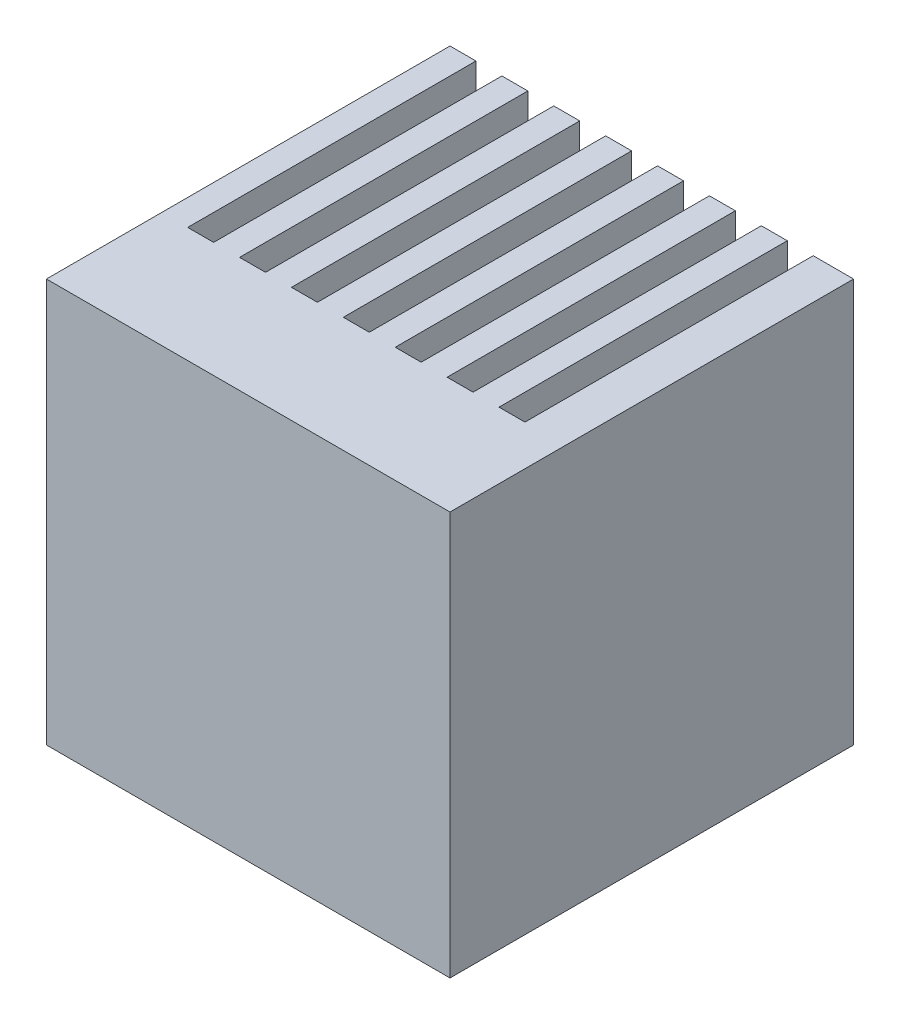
SolidWorks part; units mm, degrees
ref_plane "前视基准面" through (0, 0, 0) normal (0, 0, 1) x (1, 0, 0)
ref_plane "上视基准面" through (0, 0, 0) normal (0, 1, 0) x (1, 0, 0)
ref_plane "右视基准面" through (0, 0, 0) normal (1, 0, 0) x (0, 0, -1)
sketch "草图2" plane through (0, 0, 0) normal (0, 1, 0) x (1, 0, 0)
  line L1 (0, 0) -> (28, 0)
  line L2 (0, 0) -> (0, -28)
  line L3 (0, -28) -> (28, -28)
  line L4 (28, 0) -> (28, -28)
  dimension "D1" = 28
  dimension "D2" = 28
extrude "凸台-拉伸1" add sketch "草图2" along normal blind 28
sketch "草图3" plane through (0, 28, 0) normal (0, 1, 0) x (1, 0, 0)
  line L0 (28, 0) -> (0, 0) construction
  line L1 (1.8, 0) -> (3.6, 0)
  line L2 (1.8, 0) -> (1.8, -20)
  line L3 (1.8, -20) -> (3.6, -20)
  line L4 (3.6, 0) -> (3.6, -20)
  line L5 (0, 0) -> (0, -28) construction
  line L6 (0, -28) -> (28, -28) construction
  dimension "D1" = 1.8
  dimension "D2" = 8
  dimension "D3" = 1.8
extrude "切除-拉伸1" cut sketch "草图3" against normal through all
pattern_linear "阵列(线性)6" count 7 spacing 3.6 along (1, 0, 0) of "切除-拉伸1"
